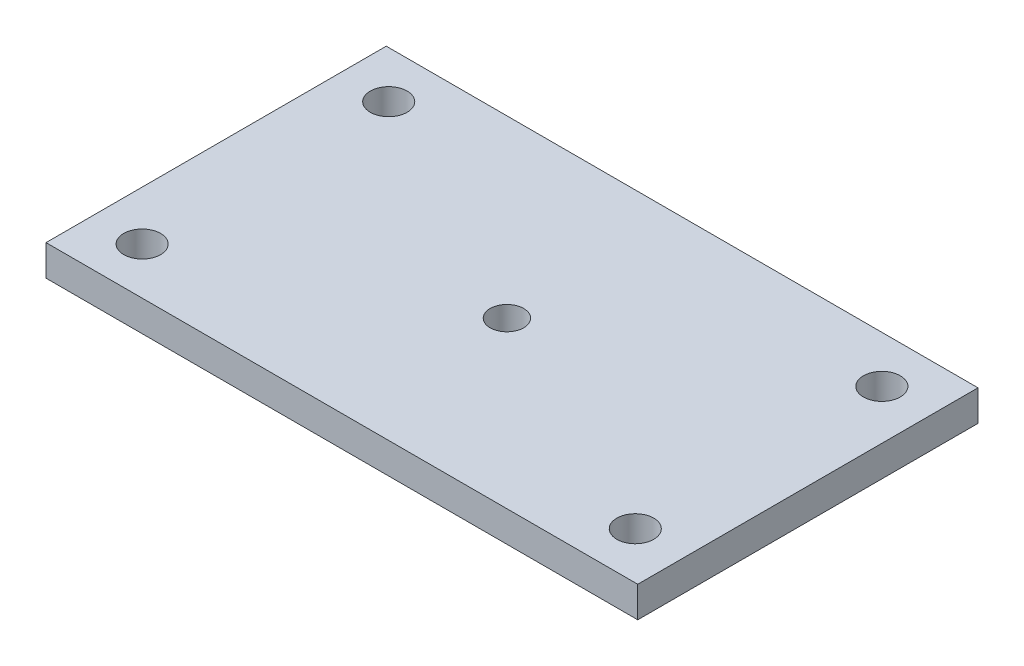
SolidWorks part; units mm, degrees
ref_plane "Front Plane" through (0, 0, 0) normal (0, 0, 1) x (1, 0, 0)
ref_plane "Top Plane" through (0, 0, 0) normal (0, 1, 0) x (1, 0, 0)
ref_plane "Right Plane" through (0, 0, 0) normal (1, 0, 0) x (0, 0, -1)
sketch "Sketch1" plane through (0, 0, 0) normal (0, 1, 0) x (1, 0, 0)
  line L1 (-56.9505, 18.0499) -> (4.0095, 18.0499)
  line L2 (-56.9505, 18.0499) -> (-56.9505, -17.0021)
  line L3 (-56.9505, -17.0021) -> (4.0095, -17.0021)
  line L4 (4.0095, 18.0499) -> (4.0095, -17.0021)
extrude "Boss-Extrude1" add sketch "Sketch1" along normal blind 3.175
hole_wizard "#25 (0.1495) Diameter Hole1" positions "Sketch2" profile "Sketch3" hole size "#25" standard "ANSI Inch"
sketch "Sketch2" plane through (0, 3.175, 0) normal (0, 1, 0) x (1, 0, 0)
  line L0 (4.0095, 18.0499) -> (-56.9505, 18.0499) construction
  line L1 (-56.9505, 18.0499) -> (-56.9505, -17.0021) construction
  line L2 (4.0095, -17.0021) -> (4.0095, 18.0499) construction
  point P0 (-51.8705, 13.2239)
  point P2 (-1.0705, 13.2239)
  point P4 (-1.0705, -12.1761)
  point P6 (-51.8705, -12.1761)
  dimension "D1" = 4.826
  dimension "D2" = 50.8
  dimension "D3" = 50.8
  dimension "D4" = 25.4
  dimension "D5" = 5.08
  dimension "D6" = 5.08
  dimension "D7" = 4.826
  dimension "D8" = 5.08
sketch "Sketch3" plane through (-51.8705, 3.175, -13.2239) normal (1, 0, 0) x (0, 0, 1)
  line L0 (0, 0) -> (0, 3.175)
  line L1 (0, 3.175) -> (1.8986, 3.175)
  line L2 (1.8986, 3.175) -> (1.8986, 0)
  line L5 (1.8986, 0) -> (0, 0)
  line L11 (0, -6.35) -> (0, 107.95) construction
  dimension "Thru Hole Dia." = 3.7973
  dimension "Thru Hole Depth" = 3.175
hole_wizard "#8-32 Tapped Hole1" positions "Sketch4" profile "Sketch5" tap size "#8-32" standard "ANSI Inch"
sketch "Sketch4" plane through (0, 0, 0) normal (0, -1, 0) x (-1, 0, 0)
  line L0 (-4.0095, 18.0499) -> (56.9505, 18.0499) construction
  line L1 (56.9505, 18.0499) -> (56.9505, -17.0021) construction
  point P0 (26.4705, 0)
  dimension "D1" = 18.0499
  dimension "D2" = 30.48
sketch "Sketch5" plane through (-26.4705, 0, 0) normal (1, 0, 0) x (0, 0, -1)
  line L0 (0, 0) -> (0, 3.175)
  line L1 (0, 3.175) -> (1.7272, 3.175)
  line L2 (1.7272, 3.175) -> (1.7272, 0)
  line L5 (1.7272, 0) -> (0, 0)
  line L11 (0, -6.35) -> (0, 107.95) construction
  dimension "Thru Tap Drill Dia." = 3.4544
  dimension "Thru Tap Drill Depth" = 3.175
